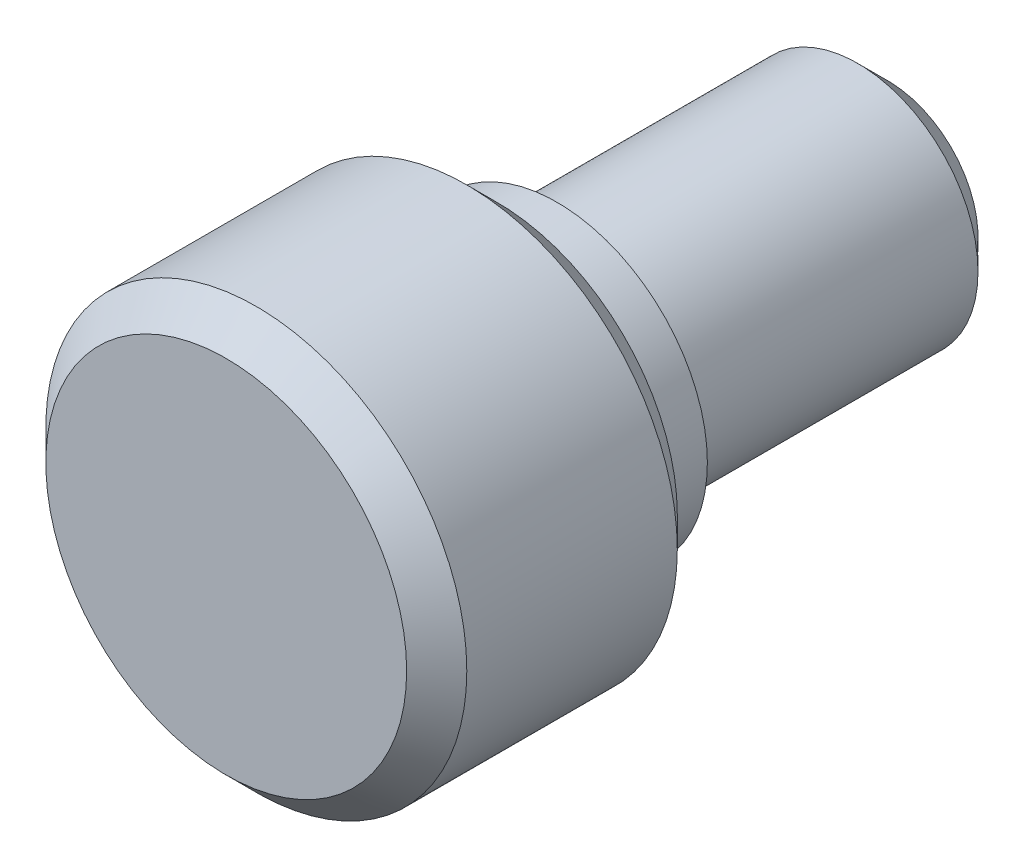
SolidWorks part; units mm, degrees
ref_plane "Face" through (0, 0, 0) normal (0, 0, 1) x (1, 0, 0)
ref_plane "Dessus" through (0, 0, 0) normal (0, 1, 0) x (1, 0, 0)
ref_plane "Droite" through (0, 0, 0) normal (1, 0, 0) x (0, 0, -1)
sketch "Esquisse1" plane through (0, 0, 0) normal (0, 0, 1) x (1, 0, 0)
  circle A0 centre (0, 0) radius 7
  dimension "D1" = 14
extrude "Base-Extrusion" add sketch "Esquisse1" along normal blind 9
chamfer "Chanfrein1" distance 1 angle 45
sketch "Esquisse2" plane through (0, 0, 0) normal (0, 0, -1) x (-1, 0, 0)
  circle A0 centre (0, 0) radius 5
  dimension "D1" = 10
extrude "Boss.-Extru.1" add sketch "Esquisse2" along normal blind 2
sketch "Esquisse3" plane through (0, 0, -2) normal (0, 0, -1) x (-1, 0, 0)
  circle A0 centre (0, 0) radius 4
  dimension "D1" = 8
extrude "Boss.-Extru.2" add sketch "Esquisse3" along normal blind 11
chamfer "Chanfrein2" distance 1 angle 45
